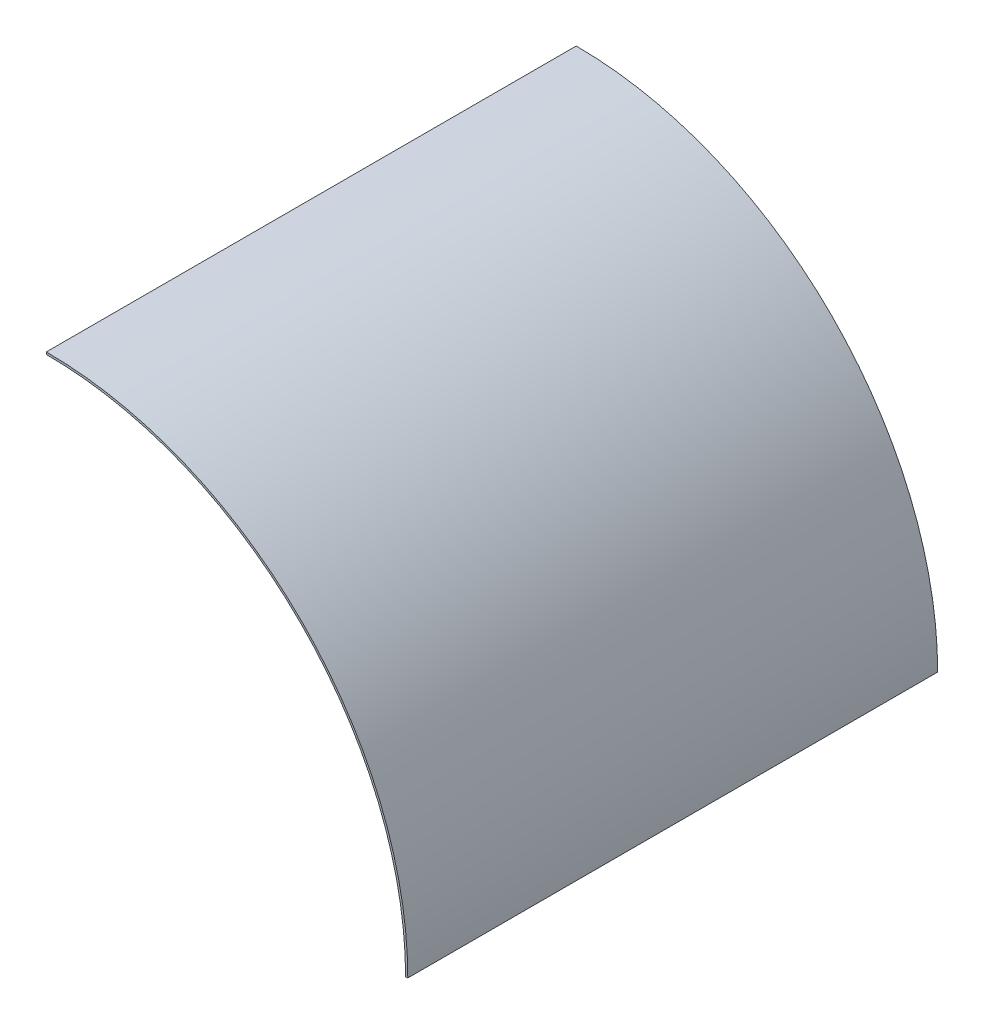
SolidWorks part; units mm, degrees
ref_plane "Front Plane" through (0, 0, 0) normal (0, 0, 1) x (1, 0, 0)
ref_plane "Top Plane" through (0, 0, 0) normal (0, 1, 0) x (1, 0, 0)
ref_plane "Right Plane" through (0, 0, 0) normal (1, 0, 0) x (0, 0, -1)
sketch "Sketch1" plane through (0, 0, 0) normal (0, 0, 1) x (1, 0, 0)
  line L0 (0, 0) -> (0, 45.174) construction
  line L1 (0, 0) -> (40.8023, 0) construction
  line L2 (0, 2046.5) -> (0, 2034)
  line L3 (2046.5, 0) -> (2034, 0)
  arc A0 (0, 2034) -> (2034, 0) centre (0, 0) cw
  arc A1 (0, 2046.5) -> (2046.5, 0) centre (0, 0) cw
  dimension "D1" = 2034
  dimension "D2" = 12.5
extrude "Boss-Extrude1" add sketch "Sketch1" against normal blind 3000
